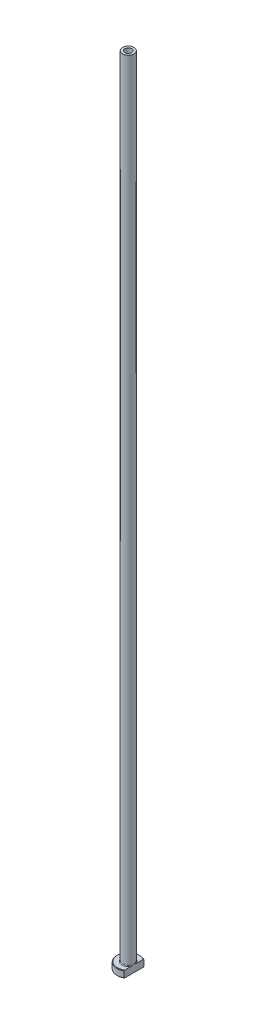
SolidWorks part; units mm, degrees
ref_plane "Front Plane" through (0, 0, 0) normal (0, 0, 1) x (1, 0, 0)
ref_plane "Top Plane" through (0, 0, 0) normal (0, 1, 0) x (1, 0, 0)
ref_plane "Right Plane" through (0, 0, 0) normal (1, 0, 0) x (0, 0, -1)
sketch "Sketch1" plane through (0, 0, 0) normal (0, 0, 1) x (1, 0, 0)
  line L0 (-1.5, 350) -> (-2.5, 350)
  line L1 (-2.5, 350) -> (-2.5, 3)
  line L2 (-2.5, 3) -> (-5, 3)
  line L3 (-5, 3) -> (-5, 0)
  line L4 (4.125, 0) -> (-4.125, 0) construction
  line L5 (-5, 0) -> (-1.75, 0)
  line L6 (-1.5, 305) -> (-1.5, 350)
  line L7 (0, 92.1877) -> (0, -15.5353) construction
  line L8 (0, -5.5) -> (0, 5.5) construction
  line L9 (-1.5, 305) -> (-1.75, 293)
  line L10 (-1.75, 293) -> (-1.75, 0)
  dimension "D1" = 0.25
  dimension "ID" = 3
  dimension "OD" = 5
  dimension "L" = 350
  dimension "H" = 10
  dimension "T" = 3
  dimension "N" = 45
  dimension "D2" = 12
  dimension "L-N" = 305
revolve "Revolve1" add sketch "Sketch1" angle 360 about L7
fillet "Fillet1" radius 0.3 1 edges at (0, 3, 2.5)
chamfer "Chamfer1" distance 0.2 angle 45 2 edges at (0, 3, 5) (0, 0, 5)
sketch "Sketch2" plane through (0, 0, 0) normal (0, -1, 0) x (1, 0, 0)
  line L0 (2.5, 4.3301) -> (2.5, -4.3301)
  circle A0 centre (0, 0) radius 5 construction
  arc A1 (2.5, 4.3301) -> (2.5, -4.3301) centre (0, 0) cw
  circle A2 centre (0, 0) radius 2.5 construction
extrude "Cut-Extrude1" cut sketch "Sketch2" against normal through all
chamfer "Chamfer2" distance 0.5 angle 45 1 edges at (0, 0, 1.75)
